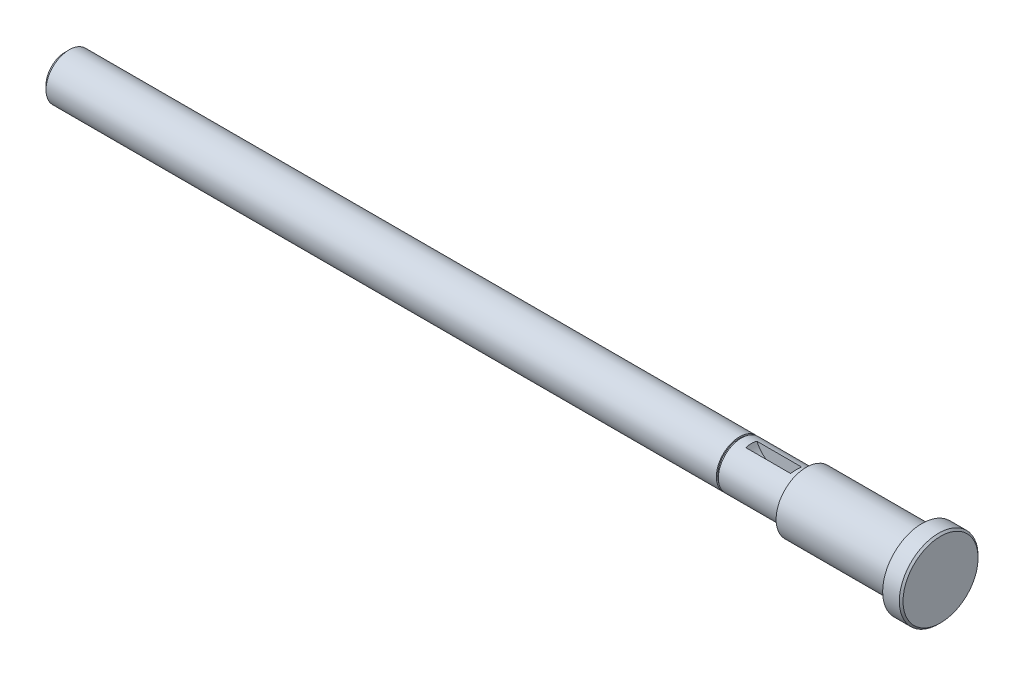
SolidWorks part; units mm, degrees
ref_plane "Plan1" through (0, 0, 0) normal (0, 0, 1) x (1, 0, 0)
ref_plane "Plan2" through (0, 0, 0) normal (0, 1, 0) x (1, 0, 0)
ref_plane "Plan3" through (0, 0, 0) normal (1, 0, 0) x (0, 0, -1)
sketch "Esquisse1" plane through (0, 0, 0) normal (0, 0, 1) x (1, 0, 0)
  line L0 (-640.6407, 0) -> (164.9443, 0) construction
  line L1 (0, 25) -> (0, 32.5)
  line L2 (0, 32.5) -> (125, 32.5)
  line L3 (125, 32.5) -> (125, 42.5)
  line L4 (125, 42.5) -> (145, 42.5)
  line L5 (145, 42.5) -> (145, 0)
  line L6 (0, 25) -> (-69.85, 25)
  line L7 (-800, 25) -> (-800, 0)
  line L8 (-72, 25) -> (-72, 23.5)
  line L9 (-72, 25) -> (-800, 25)
  line L10 (-69.85, 23.5) -> (-69.85, 25)
  line L11 (-72, 23.5) -> (-69.85, 23.5)
  line L12 (-800, 0) -> (145, 0)
  dimension "D1" = 125
  dimension "D2" = 145
  dimension "D3" = 800
  dimension "D4" = 25
  dimension "D5" = 32.5
  dimension "D6" = 42.5
  dimension "D7" = 72
  dimension "D8" = 2.15
  dimension "D9" = 23.5
revolve "Base-Révolution" add sketch "Esquisse1"
chamfer "Chanfrein2" distance 4.5 angle 45
chamfer "Chanfrein1" distance 2 angle 45
sketch "Esquisse2" plane through (0, 0, 0) normal (0, 0, 1) x (1, 0, 0)
  circle A0 centre (-35, 34) radius 26
  dimension "D2" = 52
  dimension "D1" = 35
  dimension "D3" = 34
extrude "Enlèv. mat.-Extru.1" cut sketch "Esquisse2" against normal mid plane 12
